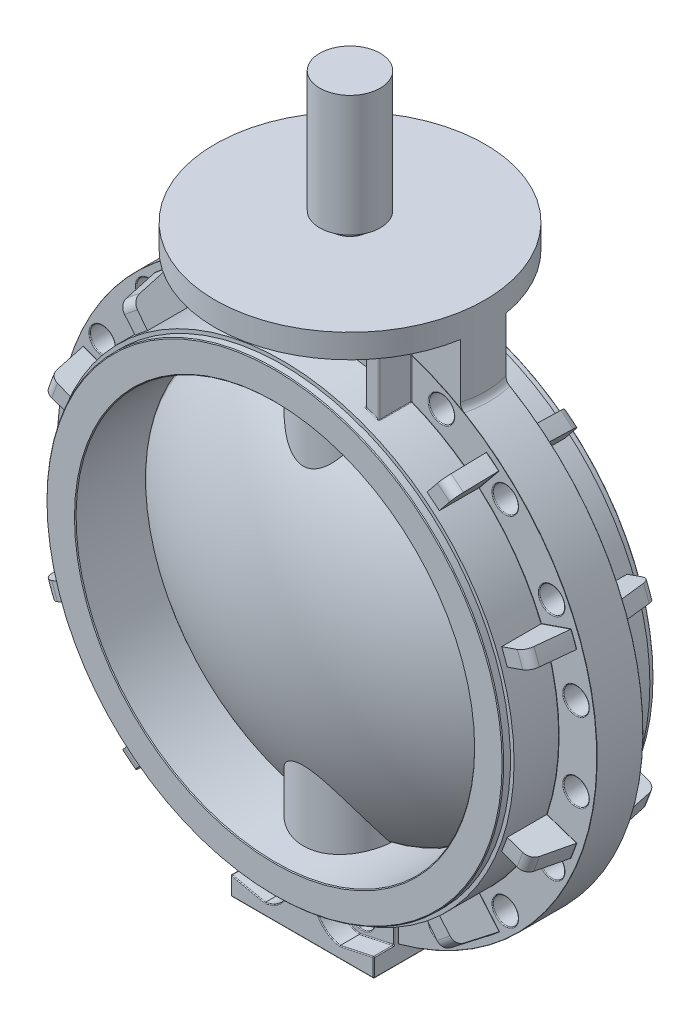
SolidWorks part; units mm, degrees
ref_plane "Front" through (0, 0, 0) normal (0, 0, 1) x (1, 0, 0)
ref_plane "Top" through (0, 0, 0) normal (0, 1, 0) x (1, 0, 0)
ref_plane "Right" through (0, 0, 0) normal (1, 0, 0) x (0, 0, -1)
sketch "Sketch1" plane through (0, 0, 0) normal (0, 0, 1) x (1, 0, 0)
  circle A0 centre (0, 0) radius 339.979
  circle A1 centre (0, 0) radius 252.73
  dimension "D1" = 679.958
  dimension "D2" = 505.46
extrude "Extrude1" add sketch "Sketch1" along normal mid plane 171
sketch "Sketch2" plane through (0, 0, 85.5) normal (0, 0, 1) x (1, 0, 0)
  circle A0 centre (0, 0) radius 292.1
  circle A1 centre (0, 0) radius 339.979 construction
  circle A2 centre (0, 0) radius 339.979
  dimension "D1" = 584.2
extrude "Cut-Extrude1" cut sketch "Sketch2" against normal blind 56.5
mirror "Mirror1" about plane through (0, 0, 0) normal (0, 0, 1) of "Cut-Extrude1"
ref_plane "Plane1" through (0, 400.05, 0) normal (0, 1, 0) x (-1, 0, 0)
sketch "Sketch3" plane through (0, 400.05, 0) normal (0, 1, 0) x (-1, 0, 0)
  circle A0 centre (0, 0) radius 170.053
  dimension "D1" = 340.106
extrude "Extrude2" add sketch "Sketch3" against normal blind 30
ref_plane "Plane2" through (0, -350.012, 0) normal (0, 1, 0) x (-1, 0, 0)
sketch "Sketch4" plane through (0, -350.012, 0) normal (0, 1, 0) x (-1, 0, 0)
  line L0 (90, 60) -> (90, -60)
  line L1 (-90, 60) -> (-90, -60)
  line L2 (0, 0) -> (0, 184.0621) construction
  line L3 (0, 0) -> (-322.6122, 0) construction
  line L4 (90, 60) -> (-90, 60)
  line L5 (90, -60) -> (-90, -60)
  dimension "D1" = 180
  dimension "D2" = 120
extrude "Extrude3" add sketch "Sketch4" along normal blind 76.2
sketch "Sketch6" plane through (0, 370.05, 0) normal (0, -1, 0) x (1, 0, 0)
  line L1 (0, 0) -> (0, -138.9352) construction
  line L2 (0, 0) -> (-336.2634, 0) construction
  line L4 (-90.0049, -59.9948) -> (90.0049, -59.9948)
  line L5 (-90.0049, -59.9948) -> (-90.0049, 59.9948)
  line L6 (-90.0049, 59.9948) -> (90.0049, 59.9948)
  line L7 (90.0049, -59.9948) -> (90.0049, 59.9948)
  dimension "D1" = 180.0098
  dimension "D2" = 119.9896
extrude "Extrude4" add sketch "Sketch6" along normal blind 101.6
sketch "Sketch5" plane through (0, 0, 60) normal (0, 0, 1) x (1, 0, 0)
  line L0 (0, 0) -> (0, -335.7316) construction
  line L1 (0, 0) -> (65.192, -327.7424) construction
  line L2 (-15.3668, -298.0257) -> (-15.3668, -291.6955)
  line L3 (-90.0049, -326.3307) -> (-47.0979, -335.5227)
  line L4 (90.0049, 370.05) -> (-90.0049, 370.05) construction
  line L5 (90.0049, -277.8876) -> (90.0049, -326.3307)
  line L6 (-90.0049, -277.8876) -> (-90.0049, -326.3307)
  line L7 (90.0049, -326.3307) -> (47.0979, -335.5227)
  line L8 (15.3668, -298.0257) -> (15.3668, -291.6955)
  line L9 (0, 0) -> (333.902, 0) construction
  line L10 (-90.0049, 277.8876) -> (-90.0049, 326.3307)
  line L11 (90.0049, 326.3307) -> (26.5458, 337.5203)
  line L12 (15.3668, 298.0257) -> (15.3668, 291.6955)
  line L13 (-15.3668, 298.0257) -> (-15.3668, 291.6955)
  line L14 (90.0049, 326.3307) -> (90.0049, 277.8876)
  line L15 (-90.0049, 326.3307) -> (-26.5458, 337.5203)
  line L16 (-90.0049, 327.8488) -> (-90.0049, 277.8876) construction
  line L17 (0, 0) -> (0, 393.1166) construction
  line L18 (-15.3668, 298.0257) -> (-15.3668, 328.14)
  line L19 (15.3668, 370.05) -> (90.0049, 370.05)
  line L20 (-90.0049, 370.05) -> (-90.0049, 351.9648)
  line L21 (15.3668, 298.0257) -> (15.3668, 328.14)
  line L22 (-15.3668, 355.948) -> (-15.3668, 370.05)
  line L23 (-15.3668, 370.05) -> (-90.0049, 370.05)
  line L24 (15.3668, 355.948) -> (15.3668, 370.05)
  line L25 (90.0049, 370.05) -> (90.0049, 351.9648)
  circle A0 centre (0, 0) radius 317.5 construction
  circle A1 centre (61.9412, -311.3993) radius 15.875 construction
  circle A2 centre (-61.9412, -311.3993) radius 15.875 construction
  arc A3 (-90, -277.8892) -> (90, -277.8892) centre (0, 0) ccw construction
  circle A4 centre (0, 0) radius 292.1 construction
  arc A5 (47.0979, -335.5227) -> (15.3668, -298.0257) centre (53.3878, -298.0257) cw
  arc A6 (-47.0979, -335.5227) -> (-15.3668, -298.0257) centre (-53.3878, -298.0257) ccw
  arc A7 (90.0049, 277.8876) -> (15.3668, 291.6955) centre (0, 0) ccw
  circle A8 centre (61.9412, 311.3993) radius 15.875 construction
  circle A9 centre (-61.9412, 311.3993) radius 15.875 construction
  arc A10 (-15.3668, 328.14) -> (-26.5458, 337.5203) centre (-24.8918, 328.14) ccw
  arc A11 (15.3668, -291.6955) -> (90.0049, -277.8876) centre (0, 0) ccw
  arc A12 (-90.0049, -277.8876) -> (-15.3668, -291.6955) centre (0, 0) ccw
  arc A13 (26.5458, 337.5203) -> (15.3668, 328.14) centre (24.8918, 328.14) ccw
  arc A15 (-90.0049, 277.8876) -> (-15.3668, 291.6955) centre (0, 0) cw
  arc A16 (-17.7792, 353.4112) -> (-80.6482, 344.5453) centre (0, 0) ccw
  arc A17 (-15.3668, 355.948) -> (-17.7792, 353.4112) centre (-17.9068, 355.948) cw
  arc A18 (-90.0049, 351.9648) -> (-80.6482, 344.5453) centre (-82.3849, 351.9648) ccw
  arc A19 (90.0049, 351.9648) -> (80.6482, 344.5453) centre (82.3849, 351.9648) cw
  arc A20 (15.3668, 355.948) -> (17.7792, 353.4112) centre (17.9068, 355.948) ccw
  arc A21 (17.7792, 353.4112) -> (80.6482, 344.5453) centre (0, 0) cw
  point P49 (-15.3668, 353.5243)
  dimension "D1" = 635
  dimension "D3" = 31.75
  dimension "D4" = 2.54
  dimension "D5" = 7.62
  dimension "D8" = 9.525
  dimension "D2" = 11.25
  dimension "D6" = 100
  dimension "D7" = 30.7337
  dimension "D9" = 41.91
  dimension "D10" = 24.8918
sketch "Sketch9" plane through (0, 0, 29) normal (0, 0, 1) x (1, 0, 0)
  line L0 (0, 0) -> (0, 387.4491) construction
  line L1 (0, 0) -> (338.3533, 0) construction
  line L2 (269.954, 111.5672) -> (309.0425, 125.0264)
  line L3 (276.9579, 92.8264) -> (315.9853, 106.2646)
  line L4 (276.9579, -92.8264) -> (316.0537, -106.0611)
  line L5 (269.954, -111.5672) -> (308.4477, -126.4869)
  line L6 (0, 0) -> (231.4921, 285.8689) construction
  line L7 (217.4767, 252.6712) -> (191.4882, 220.5781)
  line L8 (201.9338, 265.2577) -> (175.9453, 233.1645)
  line L9 (-201.2209, 265.7989) -> (-175.9453, 233.1645)
  line L10 (-218.1543, 252.0865) -> (-191.4882, 220.5781)
  line L11 (-276.9579, 92.8264) -> (-316.0537, 106.0611)
  line L12 (-269.954, 111.5672) -> (-308.4477, 126.4869)
  line L13 (201.2209, -265.7989) -> (175.9453, -233.1645)
  line L14 (218.1543, -252.0865) -> (191.4882, -220.5781)
  line L15 (-269.954, -111.5672) -> (-308.4477, -126.4869)
  line L16 (-276.9579, -92.8264) -> (-316.0537, -106.0611)
  line L17 (-218.1543, -252.0865) -> (-191.4882, -220.5781)
  line L18 (-201.2209, -265.7989) -> (-175.9453, -233.1645)
  arc A1 (-308.4477, 126.4869) -> (-316.0537, 106.0611) centre (0, 0) ccw
  arc A2 (191.4882, 220.5781) -> (175.9453, 233.1645) centre (0, 0) ccw
  circle A3 centre (0, 0) radius 292.1 construction
  arc A4 (217.4767, 252.6712) -> (201.9338, 265.2577) centre (0, 0) ccw
  arc A5 (269.954, -111.5672) -> (276.9579, -92.8264) centre (0, 0) ccw
  arc A8 (276.9579, 92.8264) -> (269.954, 111.5672) centre (0, 0) ccw
  arc A9 (-276.9579, 92.8264) -> (-269.954, 111.5672) centre (0, 0) cw
  arc A10 (-201.2209, 265.7989) -> (-218.1543, 252.0865) centre (0, 0) ccw
  arc A11 (-316.0537, -106.0611) -> (-308.4477, -126.4869) centre (0, 0) ccw
  arc A12 (-191.4882, 220.5781) -> (-175.9453, 233.1645) centre (0, 0) cw
  arc A13 (-218.1543, -252.0865) -> (-201.2209, -265.7989) centre (0, 0) ccw
  arc A14 (201.2209, -265.7989) -> (218.1543, -252.0865) centre (0, 0) ccw
  arc A15 (191.4882, -220.5781) -> (175.9453, -233.1645) centre (0, 0) cw
  arc A16 (308.4477, -126.4869) -> (316.0537, -106.0611) centre (0, 0) ccw
  arc A17 (315.9853, 106.2646) -> (309.0425, 125.0264) centre (0, 0) ccw
  arc A18 (-191.4882, -220.5781) -> (-175.9453, -233.1645) centre (0, 0) ccw
  arc A21 (-276.9579, -92.8264) -> (-269.954, -111.5672) centre (0, 0) ccw
  point P14 (0, 0)
  dimension "D5" = 666.75
  dimension "D1" = 19
  dimension "D2" = 20
  dimension "D3" = 39
  dimension "D4" = 20
extrude "Extrude7" add sketch "Sketch9" along normal blind 50
mirror "Mirror6" about plane through (0, 0, 0) normal (0, 0, 1) of "Extrude7"
chamfer "Chamfer1" distance 60 angle 10 8 edges at (-312.4176, 116.3362, 79) (-209.7997, -259.081, 79) (-312.4176, -116.3362, 79) (-209.7997, 259.081, 79) (209.7997, 259.081, 79) (312.6547, 115.6976, 79) (312.4176, -116.3362, 79) (209.7997, -259.081, 79)
chamfer "Chamfer2" distance 60 angle 10 8 edges at (312.4176, -116.3362, -79) (-209.7997, 259.081, -79) (-312.4176, 116.3362, -79) (-312.4176, -116.3362, -79) (-209.7997, -259.081, -79) (209.7997, -259.081, -79) (209.7997, 259.081, -79) (312.6547, 115.6976, -79)
fillet "Fillet3" radius 0.254 84 edges at (90, -327.8501, 0) (-90, -327.8501, 0) (-204.2517, -235.6592, 29) (-208.69, -257.7107, 29) (-188.0432, -248.7846, 29) (-134.8399, -259.1151, 29) (-90, -302.8697, 29) (-339.979, -0.0025, 29) (-134.8422, 259.1139, 29) (-188.0432, 248.7846, 29) (-208.69, 257.7107, 29) (-204.2517, 235.6592, 29) (-237.0719, 170.6439, 29) (-288.3786, 118.7084, 29) (-310.7601, 115.7347, 29) (-295.6707, 99.1611, 29) (-292.1, 0, 29) (-295.6707, -99.1611, 29) (-310.7601, -115.7347, 29) (-288.3786, -118.7084, 29) (-237.0719, -170.6439, 29) (237.0719, -170.6439, 29) (288.3786, -118.7084, 29) (310.7601, -115.7347, 29) (295.6707, -99.1611, 29) (292.1, 0, 29) (295.638, 99.2585, 29) (310.987, 115.1234, 29) (288.6635, 118.0094, 29) (237.0719, 170.6439, 29) (203.9274, 235.9392, 29) (208.69, 257.7107, 29) (188.3845, 248.5256, 29) (134.8422, 259.1139, 29) (339.979, -0.0025, 29) (90, -302.8697, 29) (134.8399, -259.1151, 29) (188.0432, -248.7846, 29) (208.69, -257.7107, 29) (204.2517, -235.6592, 29) (134.8399, -259.1151, -29) (90, -302.8697, -29) (339.979, -0.0025, -29) (134.8422, 259.1139, -29) (188.3845, 248.5256, -29) (208.69, 257.7107, -29) (203.9274, 235.9392, -29) (237.0719, 170.6439, -29) (288.6635, 118.0094, -29) (310.987, 115.1234, -29) (295.638, 99.2585, -29) (292.1, 0, -29) (295.6707, -99.1611, -29) (310.7601, -115.7347, -29) (288.3786, -118.7084, -29) (237.0719, -170.6439, -29) (204.2517, -235.6592, -29) (208.69, -257.7107, -29) (188.0432, -248.7846, -29) (-292.1, 0, -29) (-295.6707, 99.1611, -29) (-310.7601, 115.7347, -29) (-288.3786, 118.7084, -29) (-237.0719, 170.6439, -29) (-204.2517, 235.6592, -29) (-208.69, 257.7107, -29) (-188.0432, 248.7846, -29) (-134.8422, 259.1139, -29) (-339.979, -0.0025, -29) (-90, -302.8697, -29) (-134.8399, -259.1151, -29) (-188.0432, -248.7846, -29) (-208.69, -257.7107, -29) (-204.2517, -235.6592, -29) (-237.0719, -170.6439, -29) (-288.3786, -118.7084, -29) (-310.7601, -115.7347, -29) (-295.6707, -99.1611, -29) (-90.0049, 327.8488, 0) (90.0049, 327.8488, 0) (90.0049, 302.8682, 29) (-90.0049, 302.8682, 29) (-90.0049, 302.8682, -29) (90.0049, 302.8682, -29)
fillet "Fillet5" radius 12 16 edges at (-203.1417, 250.8591, -79) (-302.4721, 112.7274, -79) (-302.4721, -112.7274, -79) (-203.1417, -250.8591, -79) (203.1417, -250.8591, -79) (302.4721, -112.7274, -79) (302.6487, 112.2525, -79) (203.1417, 250.8591, -79) (-203.1417, 250.8591, 79) (-302.4721, 112.7274, 79) (-302.4721, -112.7274, 79) (-203.1417, -250.8591, 79) (203.1417, -250.8591, 79) (302.4721, -112.7274, 79) (302.6487, 112.2525, 79) (203.1417, 250.8591, 79)
sketch "Sketch11" plane through (0, 0, 0) normal (0, 0, 1) x (1, 0, 0)
  line L0 (0, 0) -> (0, 424.0344) construction
  line L1 (49.6679, 313.591) -> (0, 0) construction
  circle A0 centre (0, 0) radius 317.5 construction
  circle A1 centre (144.142, 282.8946) radius 15.875
  circle A2 centre (224.5064, 224.5064) radius 15.875
  circle A3 centre (282.8946, 144.142) radius 15.875
  circle A4 centre (313.591, 49.6679) radius 15.875
  circle A5 centre (313.591, -49.6679) radius 15.875
  circle A6 centre (282.8946, -144.142) radius 15.875
  circle A7 centre (224.5064, -224.5064) radius 15.875
  circle A8 centre (144.142, -282.8946) radius 15.875
  circle A9 centre (49.6679, -313.591) radius 15.875
  circle A10 centre (49.6679, 313.591) radius 15.875
  circle A11 centre (-49.6679, -313.591) radius 15.875
  circle A12 centre (-144.142, -282.8946) radius 15.875
  circle A13 centre (-224.5064, -224.5064) radius 15.875
  circle A14 centre (-282.8946, -144.142) radius 15.875
  circle A15 centre (-313.591, -49.6679) radius 15.875
  circle A16 centre (-313.591, 49.6679) radius 15.875
  circle A17 centre (0, 0) radius 317.5 construction
  circle A18 centre (-282.8946, 144.142) radius 15.875
  circle A19 centre (-224.5064, 224.5064) radius 15.875
  circle A20 centre (-144.142, 282.8946) radius 15.875
  circle A21 centre (-49.6679, 313.591) radius 15.875
  dimension "D1" = 635
  dimension "D2" = 31.75
  dimension "D3" = 9
sketch "Sketch12" plane through (0, 0, 0) normal (0, 0, 1) x (1, 0, 0)
  circle A0 centre (0, 0) radius 250.952
  circle A1 centre (0, 0) radius 287.528
  dimension "D1" = 501.904
  dimension "D2" = 575.056
extrude "Extrude8" add sketch "Sketch12" along normal mid plane 189.992
chamfer "Chamfer3" [suppressed] distance 2 angle 10
sketch "Sketch13" plane through (0, 0, 0) normal (0, 1, 0) x (1, 0, 0)
  line L0 (0, 0) -> (0, 179.6172) construction
  line L1 (0, 0) -> (338.4235, 0) construction
  line L2 (250.952, 3.3461) -> (250.952, -3.3461)
  line L3 (146.9958, 85.5) -> (-13.7168, 85.5) construction
  line L4 (292.1, 85.5) -> (-292.1, 85.5) construction
  line L5 (0, 92.5048) -> (0, -92.5048)
  arc A0 (247.9233, 9.4276) -> (0, 92.5048) centre (0, -318.9662) ccw
  arc A1 (247.9233, 9.4276) -> (250.952, 3.3461) centre (243.332, 3.3461) cw
  circle A2 centre (0, 0) radius 170.053 construction
  arc A3 (247.9233, -9.4276) -> (250.952, -3.3461) centre (243.332, -3.3461) ccw
  arc A4 (247.9233, -9.4276) -> (0, -92.5048) centre (0, 318.9662) cw
  point P21 (250.952, 0)
  dimension "D2" = 7.62
  dimension "D1" = 250.952
revolve "Revolve1" add sketch "Sketch13" angle 360 about L5
sketch "Sketch14" plane through (0, 0, 0) normal (0, 1, 0) x (1, 0, 0)
  circle A0 centre (0, 0) radius 58.7505
extrude "Extrude9" add sketch "Sketch14" along normal mid plane 508
extrude "Cut-Extrude2" cut sketch "Sketch5" against normal blind 25.5
extrude "Cut-Extrude3" cut sketch "Sketch11" against normal through all and the other way through all
fillet "Fillet6" radius 1 40 edges at (-329.466, -49.6679, -29) (-297.716, -49.6679, 29) (-298.7696, -144.142, -29) (-267.0196, -144.142, 29) (-240.3814, -224.5064, -29) (-208.6314, -224.5064, 29) (-160.017, -282.8946, -29) (-128.267, -282.8946, 29) (-33.7929, -313.591, -60) (-33.7929, -313.591, 34.5) (65.5429, -313.591, -60) (33.7929, -313.591, 34.5) (128.267, -282.8946, -29) (160.017, -282.8946, 29) (208.6314, -224.5064, -29) (240.3814, -224.5064, 29) (267.0196, -144.142, -29) (298.7696, -144.142, 29) (297.716, -49.6679, -29) (329.466, -49.6679, 29) (297.716, 49.6679, -29) (329.466, 49.6679, 29) (267.0196, 144.142, -29) (298.7696, 144.142, 29) (208.6314, 224.5064, -29) (240.3814, 224.5064, 29) (128.267, 282.8946, -29) (160.017, 282.8946, 29) (65.5429, 313.591, -59.9948) (65.5429, 313.591, 34.5) (-33.7929, 313.591, -59.9948) (-33.7929, 313.591, 34.5) (-160.017, 282.8946, -29) (-128.267, 282.8946, 29) (-329.466, 49.6679, -29) (-297.716, 49.6679, 29) (-298.7696, 144.142, -29) (-267.0196, 144.142, 29) (-240.3814, 224.5064, -29) (-208.6314, 224.5064, 29)
chamfer "Chamfer4" distance 1 angle 45 4 edges at (250.952, 0, -94.996) (287.528, 0, -94.996) (250.952, 0, 94.996) (287.528, 0, 94.996)
sketch "Sketch15" plane through (0, 370.05, 0) normal (0, -1, 0) x (1, 0, 0)
  line L0 (-90.1866, 28.746) -> (-339.979, 28.746) construction
  line L1 (-339.979, -28.746) -> (-90.1866, -28.746) construction
  line L2 (167.6058, 28.746) -> (90.0049, 28.746)
  line L3 (-167.6058, -28.746) -> (-90.0049, -28.746)
  line L4 (-90.0049, -28.746) -> (-90.0049, 28.746)
  line L5 (90.0049, -28.746) -> (90.0049, 28.746)
  line L6 (90.0049, -28.746) -> (167.6058, -28.746)
  line L7 (-90.0049, 28.746) -> (-167.6058, 28.746)
  arc A0 (167.6058, -28.746) -> (167.6058, 28.746) centre (0, 0) ccw
  arc A1 (-167.6058, 28.746) -> (-167.6058, -28.746) centre (0, 0) ccw
extrude "Extrude10" add sketch "Sketch15" along normal up to next
fillet "Fillet8" radius 10 2 edges
sketch "Sketch16" plane through (0, 370.05, 0) normal (0, -1, 0) x (1, 0, 0)
  line L0 (-90.0049, -59.9948) -> (-90.0049, 70.0507)
  line L1 (-90.0049, -59.9948) -> (-90.0049, -70.0507)
  line L2 (90.0049, -59.9948) -> (90.0049, -70.0507)
  line L3 (90.0049, -59.9948) -> (90.0049, 70.0507)
  line L4 (-106.5149, -70.0507) -> (-106.5149, 70.0507)
  line L5 (106.5149, -70.0507) -> (106.5149, 70.0507)
  line L6 (-106.5149, -70.0507) -> (-90.0049, -70.0507)
  line L7 (0, 0) -> (-140.4319, 0) construction
  line L8 (-106.5149, 70.0507) -> (-90.0049, 70.0507)
  line L9 (90.0049, -70.0507) -> (106.5149, -70.0507)
  line L10 (90.0049, 70.0507) -> (106.5149, 70.0507)
  dimension "D1" = 16.51
  dimension "D2" = 16.51
extrude "Extrude11" add sketch "Sketch16" along normal up to next
mirror "Mirror8" about plane through (0, 0, 0) normal (0, 0, 1) of "Cut-Extrude2"
fillet "Fillet10" radius 1 144 edges at (-106.5149, 272.4713, 29.4144) (-106.5149, 322.8036, 28.9053) (-106.5149, 297.4275, 29) (-106.5149, 271.9871, 49.6523) (-106.5149, 321.0186, 70.0507) (-106.5149, 370.05, 49.3983) (-98.3042, 275.0613, 70.0507) (-90.0049, 323.9688, 70.0507) (-98.2599, 370.05, 70.0507) (-90.0049, 370.05, 52.2753) (-90.0049, 277.8876, 52.2753) (-90.0049, 370.05, -52.2753) (-90.0049, 323.9688, -70.0507) (-106.5149, 272.4662, -29.4201) (-98.3042, 275.0613, -70.0507) (-90.0049, 277.8876, -52.2753) (-106.5149, 271.9871, -49.6523) (-106.5149, 321.0186, -70.0507) (-98.2599, 370.05, -70.0507) (-106.5149, 370.05, -49.3983) (-106.5149, 297.4275, -29) (-106.5149, 322.7773, -28.9321) (106.5149, 272.43, 29.4525) (90.0049, 277.8876, 52.2753) (90.0049, 323.9688, 70.0507) (90.0049, 370.05, 52.2753) (98.3042, 275.0613, 70.0507) (106.5149, 321.0186, 70.0507) (98.2599, 370.05, 70.0507) (106.5149, 271.9871, 49.6523) (106.5149, 297.4275, 29) (106.5149, 322.7563, 28.9488) (106.5149, 370.05, 49.3983) (90.0049, 370.05, -52.2753) (106.5149, 272.45, -29.4361) (90.0049, 277.8876, -52.2753) (98.3042, 275.0613, -70.0507) (106.5149, 271.9871, -49.6523) (106.5149, 322.8149, -28.8909) (106.5149, 297.4275, -29) (106.5149, 321.0186, -70.0507) (106.5149, 370.05, -49.3983) (90.0049, 323.9688, -70.0507) (98.2599, 370.05, -70.0507) (-90, -338.1719, -60) (-90, -326.3318, -47.25) (0, -292.1, -60) (-15.3668, -291.6955, -47.25) (-68.5489, -330.9273, -60) (-68.5489, -330.9273, -34.5) (-24.3642, -322.5862, -34.5) (-90, -302.1105, -34.5) (-24.3642, -322.5862, -60) (-15.3668, -294.8606, -60) (-65.5429, -313.591, -34.5) (90, -338.1719, -60) (90, -277.8892, -31.877) (90, -326.3318, -47.25) (68.5489, -330.9273, -60) (65.5429, -313.591, -34.5) (68.5489, -330.9273, -34.5) (90, -302.1105, -34.5) (24.3642, -322.5862, -34.5) (24.3642, -322.5862, -60) (15.3668, -294.8606, -60) (15.3668, -291.6955, -47.25) (-90.0049, 339.1478, -59.9948) (0, 292.1, -59.9948) (-15.3668, 309.9178, -59.9948) (-18.7693, 335.4366, -59.9948) (-90.0049, 326.3307, -47.2474) (-15.3668, 291.6955, -47.2474) (-58.2754, 331.9255, -59.9948) (90.0049, 339.1478, -59.9948) (18.7693, 335.4366, -59.9948) (15.3668, 291.6955, -47.2474) (90.0049, 326.3307, -47.2474) (15.3668, 309.9178, -59.9948) (58.2754, 331.9255, -59.9948) (0, 370.05, -59.9948) (-16.0662, 354.1977, -59.9948) (-49.413, 350.3911, -59.9948) (-15.3668, 370.05, -47.2474) (-87.1194, 345.9941, -59.9948) (-15.3668, 362.999, -59.9948) (49.413, 350.3911, -59.9948) (16.0662, 354.1977, -59.9948) (15.3668, 370.05, -47.2474) (87.1194, 345.9941, -59.9948) (15.3668, 362.999, -59.9948) (0, -350.012, -60) (0, -350.012, 60) (90, -350.012, 0) (-90, -350.012, 0) (-90, -277.8892, 31.877) (-90, -277.8892, -31.877) (90.0856, -277.9515, -29.0638) (90.0856, -277.9515, 29.0638) (-90.0856, -277.9515, 29.0638) (-90.0856, -277.9515, -29.0638) (-90, -338.1719, 60) (-90, -302.1105, 34.5) (-90, -326.3318, 47.25) (0, -292.1, 60) (-68.5489, -330.9273, 34.5) (-68.5489, -330.9273, 60) (-24.3642, -322.5862, 60) (-15.3668, -294.8606, 60) (-15.3668, -291.6955, 47.25) (-24.3642, -322.5862, 34.5) (90, -277.8892, 31.877) (90, -338.1719, 60) (90, -302.1105, 34.5) (90, -326.3318, 47.25) (15.3668, -291.6955, 47.25) (68.5489, -330.9273, 34.5) (15.3668, -294.8606, 60) (24.3642, -322.5862, 60) (68.5489, -330.9273, 60) (24.3642, -322.5862, 34.5) (-90.0049, 339.1478, 59.9948) (0, 292.1, 59.9948) (-58.2754, 331.9255, 59.9948) (-18.7693, 335.4366, 59.9948) (-15.3668, 309.9178, 59.9948) (-15.3668, 291.6955, 47.2474) (-90.0049, 326.3307, 47.2474) (90.0049, 339.1478, 59.9948) (15.3668, 309.9178, 59.9948) (18.7693, 335.4366, 59.9948) (58.2754, 331.9255, 59.9948) (90.0049, 326.3307, 47.2474) (15.3668, 291.6955, 47.2474) (-87.1194, 345.9941, 59.9948) (-49.413, 350.3911, 59.9948) (-16.0662, 354.1977, 59.9948) (-15.3668, 362.999, 59.9948) (-15.3668, 370.05, 47.2474) (0, 370.05, 59.9948) (15.3668, 362.999, 59.9948) (16.0662, 354.1977, 59.9948) (49.413, 350.3911, 59.9948) (87.1194, 345.9941, 59.9948) (15.3668, 370.05, 47.2474)
sketch "Sketch17" plane through (0, 400.05, 0) normal (0, 1, 0) x (1, 0, 0)
  circle A0 centre (0, 0) radius 22.225
  dimension "D1" = 44.45
extrude "Extrude12" add sketch "Sketch17" along normal blind 12.7
sketch "Sketch18" plane through (0, 412.75, 0) normal (0, 1, 0) x (1, 0, 0)
  circle A0 centre (0, 0) radius 38.1
  dimension "D1" = 76.2
extrude "Extrude13" add sketch "Sketch18" along normal blind 152.4
